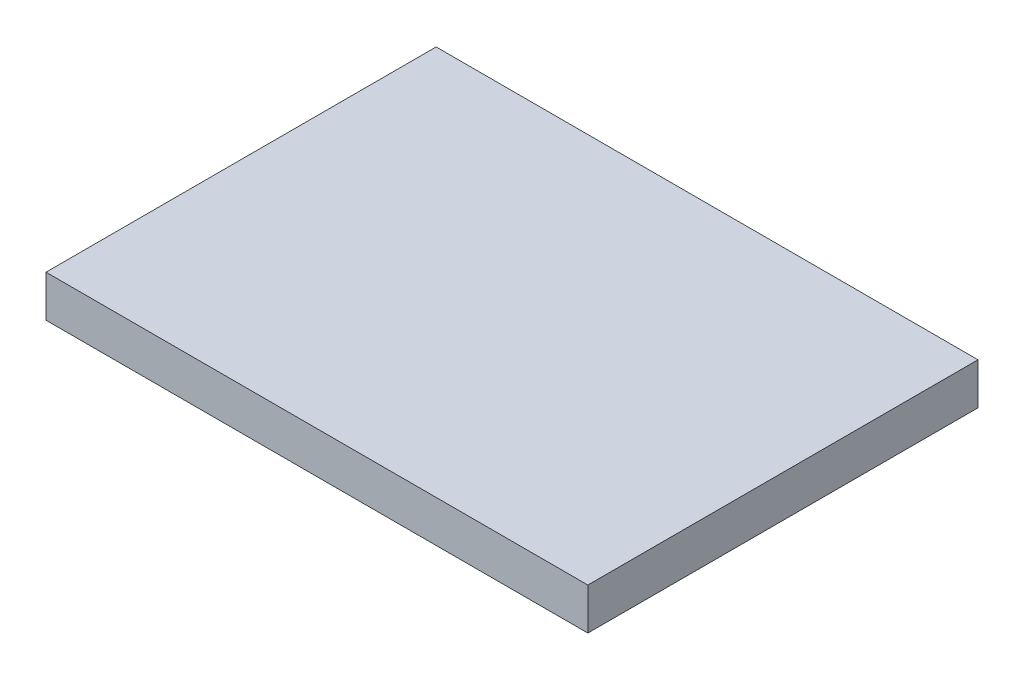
SolidWorks part; units mm, degrees
ref_plane "Front Plane" through (0, 0, 0) normal (0, 0, 1) x (1, 0, 0)
ref_plane "Top Plane" through (0, 0, 0) normal (0, 1, 0) x (1, 0, 0)
ref_plane "Right Plane" through (0, 0, 0) normal (1, 0, 0) x (0, 0, -1)
sketch "Sketch1" plane through (0, 0, 0) normal (0, 1, 0) x (1, 0, 0)
  line L1 (-7.9375, 5.715) -> (7.9375, 5.715)
  line L2 (-7.9375, 5.715) -> (-7.9375, -5.715)
  line L3 (-7.9375, -5.715) -> (7.9375, -5.715)
  line L4 (7.9375, 5.715) -> (7.9375, -5.715)
  line L5 (-7.9375, 5.715) -> (7.9375, -5.715) construction
  line L6 (-7.9375, -5.715) -> (7.9375, 5.715) construction
  point P0 (0, 0)
  dimension "D1" = 11.43
  dimension "D2" = 15.875
base flange "Base-Flange1" sketch "Sketch1" thickness 1.2192 reverse thickness direction no parameters "D1"=0.7366
sketch "Bend-Lines1" [suppressed] plane through (0, 0, 0) normal (0, 1, 0) x (1, 0, 0)
sketch "Bounding-Box1" [suppressed] plane through (0, 0, 0) normal (0, 1, 0) x (1, 0, 0)
sheet metal parameters "Sheet-Metal1" thickness 1.2192 parameters "D1"=0.7366
flat pattern "Flat-Pattern1"
sketch "Bend-Lines2" plane through (0, 0, 0) normal (0, 1, 0) x (1, 0, 0)
sketch3d "Bounding-Box2" [suppressed]
  line L0 (7.9375, -5.715, 0) -> (-7.9375, -5.715, 0) construction
  line L1 (7.9375, 5.715, 0) -> (-7.9375, 5.715, 0) construction
  line L2 (7.9375, -5.715, 0) -> (7.9375, 5.715, 0) construction
  line L3 (-7.9375, -5.715, 0) -> (-7.9375, 5.715, 0) construction
